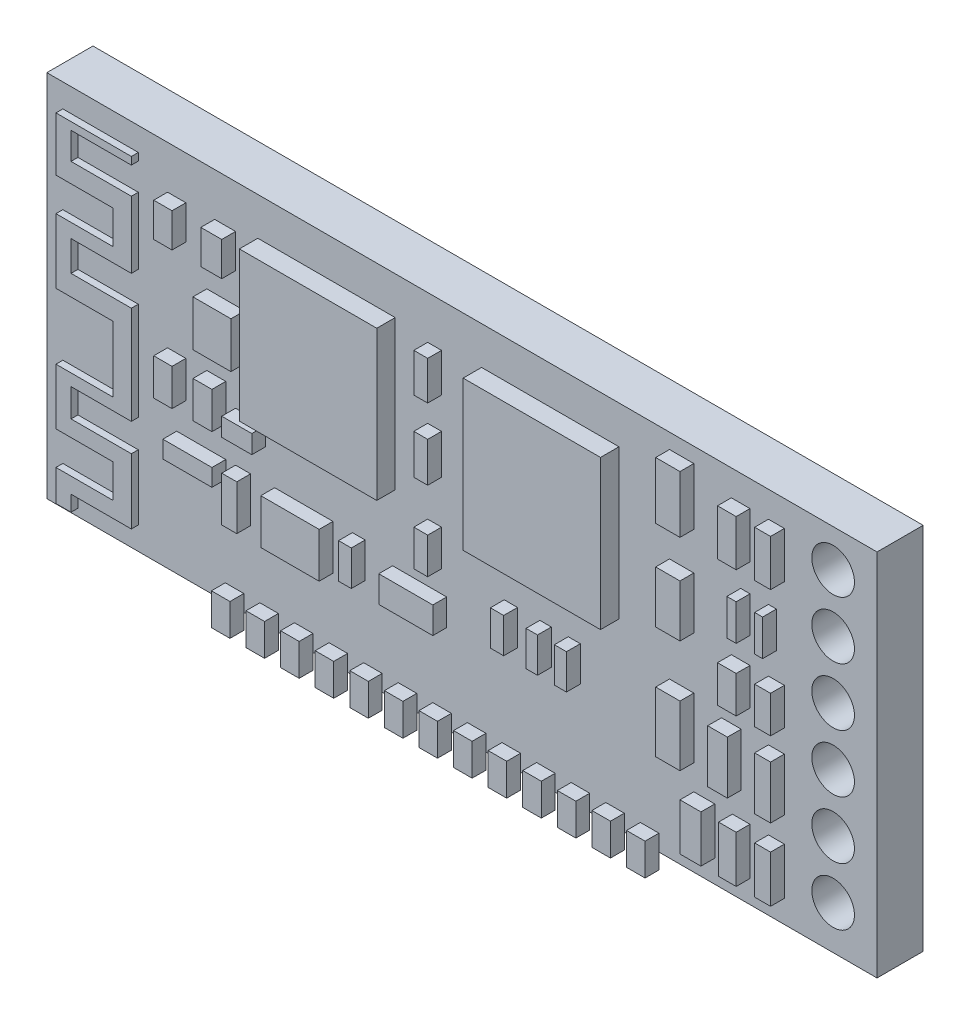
SolidWorks part; units mm, degrees
ref_plane "정면" through (0, 0, 0) normal (0, 0, 1) x (1, 0, 0)
ref_plane "윗면" through (0, 0, 0) normal (0, 1, 0) x (1, 0, 0)
ref_plane "우측면" through (0, 0, 0) normal (1, 0, 0) x (0, 0, -1)
sketch "스케치1" plane through (0, 0, 0) normal (0, 0, 1) x (1, 0, 0)
  line L1 (-50.3316, 76.0919) -> (-46.7316, 76.0919)
  line L2 (-50.3316, 76.0919) -> (-50.3316, 74.4919)
  line L3 (-50.3316, 74.4919) -> (-46.7316, 74.4919)
  line L4 (-46.7316, 76.0919) -> (-46.7316, 74.4919)
  line L5 (-50.3316, 76.0919) -> (-46.7316, 74.4919) construction
  line L6 (-50.3316, 74.4919) -> (-46.7316, 76.0919) construction
  point P0 (-48.5316, 75.2919)
extrude "보스-돌출1" add sketch "스케치1" along normal blind 0.2
sketch "스케치2" plane through (0, 0, 0.2) normal (0, 0, 1) x (1, 0, 0)
  circle A0 centre (-46.9221, 75.9292) radius 0.0924
  circle A1 centre (-46.9221, 75.6792) radius 0.0924
  circle A2 centre (-46.9221, 75.4292) radius 0.0924
  circle A3 centre (-46.9221, 75.1792) radius 0.0924
  circle A4 centre (-46.9221, 74.9292) radius 0.0924
  circle A5 centre (-46.9221, 74.6792) radius 0.0924
  dimension "D1" = 6
extrude "컷-돌출1" cut sketch "스케치2" against normal blind 0.2
sketch "스케치3" plane through (0, 0, 0.2) normal (0, 0, 1) x (1, 0, 0)
  line L0 (-49.9725, 75.9904) -> (-50.2622, 75.9904)
  line L1 (-50.2622, 75.9904) -> (-50.2622, 75.7569)
  line L2 (-50.2622, 75.7569) -> (-50.0146, 75.7569)
  line L3 (-50.0146, 75.7569) -> (-50.0146, 75.612)
  line L4 (-50.0146, 75.612) -> (-50.2622, 75.612)
  line L5 (-50.2622, 75.612) -> (-50.2622, 75.3317)
  line L6 (-50.2622, 75.3317) -> (-50.0146, 75.3317)
  line L7 (-50.0146, 75.3317) -> (-50.0146, 75.0468)
  line L8 (-50.0146, 75.0468) -> (-50.2622, 75.0468)
  line L9 (-50.2622, 75.0468) -> (-50.2622, 74.8039)
  line L10 (-50.2622, 74.8039) -> (-50.0146, 74.8039)
  line L11 (-50.0146, 74.8039) -> (-50.0146, 74.659)
  line L12 (-50.0146, 74.659) -> (-50.2622, 74.659)
  line L13 (-50.2622, 74.659) -> (-50.2622, 74.5236)
  line L14 (-50.2622, 74.5236) -> (-50.1968, 74.5236)
  line L15 (-50.1968, 74.5236) -> (-50.1968, 74.5913)
  line L16 (-50.1968, 74.5913) -> (-49.9352, 74.5913)
  line L17 (-49.9352, 74.5913) -> (-49.9352, 74.8739)
  line L18 (-49.9352, 74.8739) -> (-50.1968, 74.8739)
  line L19 (-50.1968, 74.8739) -> (-50.1968, 74.9954)
  line L20 (-50.1968, 74.9954) -> (-49.9352, 74.9954)
  line L21 (-49.9352, 74.9954) -> (-49.9352, 75.4205)
  line L22 (-49.9352, 75.4205) -> (-50.1968, 75.4205)
  line L23 (-50.1968, 75.4205) -> (-50.1968, 75.5513)
  line L24 (-50.1968, 75.5513) -> (-49.9352, 75.5513)
  line L25 (-49.9352, 75.5513) -> (-49.9352, 75.841)
  line L26 (-49.9352, 75.841) -> (-50.1968, 75.841)
  line L27 (-50.1968, 75.841) -> (-50.1968, 75.9577)
  line L28 (-50.1968, 75.9577) -> (-49.9352, 75.9577)
  line L29 (-49.9352, 75.9577) -> (-49.9352, 75.9904)
  line L30 (-49.9352, 75.9904) -> (-49.9725, 75.9904)
extrude "보스-돌출2" add sketch "스케치3" along normal blind 0.03
sketch "스케치4" plane through (0, 0, 0.2) normal (0, 0, 1) x (1, 0, 0)
  line L1 (-48.4465, 75.9274) -> (-47.8508, 75.9274)
  line L2 (-48.4465, 75.9274) -> (-48.4465, 75.2806)
  line L3 (-48.4465, 75.2806) -> (-47.8508, 75.2806)
  line L4 (-47.8508, 75.9274) -> (-47.8508, 75.2806)
  line L5 (-49.4167, 75.9274) -> (-48.821, 75.9274)
  line L6 (-49.4167, 75.9274) -> (-49.4167, 75.2806)
  line L7 (-49.4167, 75.2806) -> (-48.821, 75.2806)
  line L8 (-48.821, 75.9274) -> (-48.821, 75.2806)
extrude "보스-돌출3" add sketch "스케치4" along normal blind 0.08
sketch "스케치5" plane through (0, 0, 0.2) normal (0, 0, 1) x (1, 0, 0)
  line L1 (-49.604, 75.9047) -> (-49.5132, 75.9047)
  line L2 (-49.604, 75.9047) -> (-49.604, 75.7572)
  line L3 (-49.604, 75.7572) -> (-49.5132, 75.7572)
  line L4 (-49.5132, 75.9047) -> (-49.5132, 75.7572)
  line L5 (-49.8082, 75.9047) -> (-49.7288, 75.9047)
  line L6 (-49.8082, 75.9047) -> (-49.8082, 75.7572)
  line L7 (-49.8082, 75.7572) -> (-49.7288, 75.7572)
  line L8 (-49.7288, 75.9047) -> (-49.7288, 75.7572)
  line L9 (-49.638, 75.6267) -> (-49.4735, 75.6267)
  line L10 (-49.638, 75.6267) -> (-49.638, 75.4281)
  line L11 (-49.638, 75.4281) -> (-49.4735, 75.4281)
  line L12 (-49.4735, 75.6267) -> (-49.4735, 75.4281)
  line L13 (-49.8082, 75.3203) -> (-49.7288, 75.3203)
  line L14 (-49.8082, 75.3203) -> (-49.8082, 75.1614)
  line L15 (-49.8082, 75.1614) -> (-49.7288, 75.1614)
  line L16 (-49.7288, 75.3203) -> (-49.7288, 75.1614)
  line L17 (-49.638, 75.3203) -> (-49.5557, 75.3203)
  line L18 (-49.638, 75.3203) -> (-49.638, 75.1614)
  line L19 (-49.638, 75.1614) -> (-49.5557, 75.1614)
  line L20 (-49.5557, 75.3203) -> (-49.5557, 75.1614)
  line L21 (-49.5132, 75.2409) -> (-49.3829, 75.2409)
  line L22 (-49.5132, 75.2409) -> (-49.5132, 75.1614)
  line L23 (-49.5132, 75.1614) -> (-49.3829, 75.1614)
  line L24 (-49.3829, 75.2409) -> (-49.3829, 75.1614)
  line L25 (-49.7685, 75.027) -> (-49.5557, 75.027)
  line L26 (-49.7685, 75.027) -> (-49.7685, 74.9524)
  line L27 (-49.7685, 74.9524) -> (-49.5557, 74.9524)
  line L28 (-49.5557, 75.027) -> (-49.5557, 74.9524)
  line L29 (-49.5132, 75.027) -> (-49.448, 75.027)
  line L30 (-49.5132, 75.027) -> (-49.5132, 74.8323)
  line L31 (-49.5132, 74.8323) -> (-49.448, 74.8323)
  line L32 (-49.448, 75.027) -> (-49.448, 74.8323)
  line L33 (-49.344, 75.027) -> (-49.0909, 75.027)
  line L34 (-49.344, 75.027) -> (-49.344, 74.8323)
  line L35 (-49.344, 74.8323) -> (-49.0909, 74.8323)
  line L36 (-49.0909, 75.027) -> (-49.0909, 74.8323)
  line L37 (-49.0066, 75.027) -> (-48.9514, 75.027)
  line L38 (-49.0066, 75.027) -> (-49.0066, 74.8745)
  line L39 (-49.0066, 74.8745) -> (-48.9514, 74.8745)
  line L40 (-48.9514, 75.027) -> (-48.9514, 74.8745)
  line L41 (-48.8323, 74.9897) -> (-48.598, 74.9897)
  line L42 (-48.8323, 74.9897) -> (-48.8323, 74.8745)
  line L43 (-48.8323, 74.8745) -> (-48.598, 74.8745)
  line L44 (-48.598, 74.9897) -> (-48.598, 74.8745)
  line L45 (-48.6803, 75.2409) -> (-48.6201, 75.2409)
  line L46 (-48.6803, 75.2409) -> (-48.6803, 75.0843)
  line L47 (-48.6803, 75.0843) -> (-48.6201, 75.0843)
  line L48 (-48.6201, 75.2409) -> (-48.6201, 75.0843)
  line L49 (-48.6803, 75.6005) -> (-48.6201, 75.6005)
  line L50 (-48.6803, 75.6005) -> (-48.6803, 75.4281)
  line L51 (-48.6803, 75.4281) -> (-48.6201, 75.4281)
  line L52 (-48.6201, 75.6005) -> (-48.6201, 75.4281)
  line L53 (-48.6803, 75.9047) -> (-48.6201, 75.9047)
  line L54 (-48.6803, 75.9047) -> (-48.6803, 75.7367)
  line L55 (-48.6803, 75.7367) -> (-48.6201, 75.7367)
  line L56 (-48.6201, 75.9047) -> (-48.6201, 75.7367)
  line L57 (-48.3482, 75.104) -> (-48.2906, 75.104)
  line L58 (-48.3482, 75.104) -> (-48.3482, 74.9524)
  line L59 (-48.3482, 74.9524) -> (-48.2906, 74.9524)
  line L60 (-48.2906, 75.104) -> (-48.2906, 74.9524)
  line L61 (-48.1937, 75.104) -> (-48.144, 75.104)
  line L62 (-48.1937, 75.104) -> (-48.1937, 74.9524)
  line L63 (-48.1937, 74.9524) -> (-48.144, 74.9524)
  line L64 (-48.144, 75.104) -> (-48.144, 74.9524)
  line L65 (-48.0707, 75.104) -> (-48.0183, 75.104)
  line L66 (-48.0707, 75.104) -> (-48.0707, 74.9524)
  line L67 (-48.0707, 74.9524) -> (-48.0183, 74.9524)
  line L68 (-48.0183, 75.104) -> (-48.0183, 74.9524)
extrude "보스-돌출4" add sketch "스케치5" along normal blind 0.06
sketch "스케치6" plane through (0, 0, 0.2) normal (0, 0, 1) x (1, 0, 0)
  line L0 (-49.408, 74.5629) -> (-49.3275, 74.5629)
  line L1 (-49.558, 74.5629) -> (-49.4775, 74.5629)
  line L2 (-49.558, 74.5629) -> (-49.558, 74.4243)
  line L3 (-49.558, 74.4243) -> (-49.4775, 74.4243)
  line L4 (-49.4775, 74.5629) -> (-49.4775, 74.4243)
  line L5 (-49.408, 74.5629) -> (-49.408, 74.4243)
  line L6 (-49.3275, 74.5629) -> (-49.3275, 74.4243)
  line L7 (-49.408, 74.4243) -> (-49.3275, 74.4243)
  line L8 (-49.258, 74.5629) -> (-49.1775, 74.5629)
  line L9 (-49.258, 74.5629) -> (-49.258, 74.4243)
  line L10 (-49.1775, 74.5629) -> (-49.1775, 74.4243)
  line L11 (-49.258, 74.4243) -> (-49.1775, 74.4243)
  line L12 (-49.108, 74.5629) -> (-49.0275, 74.5629)
  line L13 (-49.108, 74.5629) -> (-49.108, 74.4243)
  line L14 (-49.0275, 74.5629) -> (-49.0275, 74.4243)
  line L15 (-49.108, 74.4243) -> (-49.0275, 74.4243)
  line L16 (-48.958, 74.5629) -> (-48.8775, 74.5629)
  line L17 (-48.958, 74.5629) -> (-48.958, 74.4243)
  line L18 (-48.8775, 74.5629) -> (-48.8775, 74.4243)
  line L19 (-48.958, 74.4243) -> (-48.8775, 74.4243)
  line L20 (-48.808, 74.5629) -> (-48.7275, 74.5629)
  line L21 (-48.808, 74.5629) -> (-48.808, 74.4243)
  line L22 (-48.7275, 74.5629) -> (-48.7275, 74.4243)
  line L23 (-48.808, 74.4243) -> (-48.7275, 74.4243)
  line L24 (-48.658, 74.5629) -> (-48.5775, 74.5629)
  line L25 (-48.658, 74.5629) -> (-48.658, 74.4243)
  line L26 (-48.5775, 74.5629) -> (-48.5775, 74.4243)
  line L27 (-48.658, 74.4243) -> (-48.5775, 74.4243)
  line L28 (-48.508, 74.5629) -> (-48.4275, 74.5629)
  line L29 (-48.508, 74.5629) -> (-48.508, 74.4243)
  line L30 (-48.4275, 74.5629) -> (-48.4275, 74.4243)
  line L31 (-48.508, 74.4243) -> (-48.4275, 74.4243)
  line L32 (-48.358, 74.5629) -> (-48.2775, 74.5629)
  line L33 (-48.358, 74.5629) -> (-48.358, 74.4243)
  line L34 (-48.2775, 74.5629) -> (-48.2775, 74.4243)
  line L35 (-48.358, 74.4243) -> (-48.2775, 74.4243)
  line L36 (-48.208, 74.5629) -> (-48.1275, 74.5629)
  line L37 (-48.208, 74.5629) -> (-48.208, 74.4243)
  line L38 (-48.1275, 74.5629) -> (-48.1275, 74.4243)
  line L39 (-48.208, 74.4243) -> (-48.1275, 74.4243)
  line L40 (-48.058, 74.5629) -> (-47.9775, 74.5629)
  line L41 (-48.058, 74.5629) -> (-48.058, 74.4243)
  line L42 (-47.9775, 74.5629) -> (-47.9775, 74.4243)
  line L43 (-48.058, 74.4243) -> (-47.9775, 74.4243)
  line L44 (-47.908, 74.5629) -> (-47.8275, 74.5629)
  line L45 (-47.908, 74.5629) -> (-47.908, 74.4243)
  line L46 (-47.8275, 74.5629) -> (-47.8275, 74.4243)
  line L47 (-47.908, 74.4243) -> (-47.8275, 74.4243)
  line L48 (-47.758, 74.5629) -> (-47.6775, 74.5629)
  line L49 (-47.758, 74.5629) -> (-47.758, 74.4243)
  line L50 (-47.6775, 74.5629) -> (-47.6775, 74.4243)
  line L51 (-47.758, 74.4243) -> (-47.6775, 74.4243)
  dimension "D1" = 13
extrude "보스-돌출5" add sketch "스케치6" along normal blind 0.06
sketch "스케치7" plane through (0, 0, 0.2) normal (0, 0, 1) x (1, 0, 0)
  line L1 (-47.6316, 76.0266) -> (-47.5261, 76.0266)
  line L2 (-47.6316, 76.0266) -> (-47.6316, 75.7793)
  line L3 (-47.6316, 75.7793) -> (-47.5261, 75.7793)
  line L4 (-47.5261, 76.0266) -> (-47.5261, 75.7793)
  line L5 (-47.6316, 75.6157) -> (-47.5261, 75.6157)
  line L6 (-47.6316, 75.6157) -> (-47.6316, 75.3902)
  line L7 (-47.6316, 75.3902) -> (-47.5261, 75.3902)
  line L8 (-47.5261, 75.6157) -> (-47.5261, 75.3902)
  line L9 (-47.6316, 75.1647) -> (-47.5261, 75.1647)
  line L10 (-47.6316, 75.1647) -> (-47.6316, 74.9029)
  line L11 (-47.6316, 74.9029) -> (-47.5261, 74.9029)
  line L12 (-47.5261, 75.1647) -> (-47.5261, 74.9029)
  line L13 (-47.5261, 74.7938) -> (-47.4352, 74.7938)
  line L14 (-47.5261, 74.7938) -> (-47.5261, 74.5901)
  line L15 (-47.5261, 74.5901) -> (-47.4352, 74.5901)
  line L16 (-47.4352, 74.7938) -> (-47.4352, 74.5901)
  line L17 (-47.3589, 74.7938) -> (-47.2825, 74.7938)
  line L18 (-47.3589, 74.7938) -> (-47.3589, 74.5901)
  line L19 (-47.3589, 74.5901) -> (-47.2825, 74.5901)
  line L20 (-47.2825, 74.7938) -> (-47.2825, 74.5901)
  line L21 (-47.2025, 74.7938) -> (-47.1334, 74.7938)
  line L22 (-47.2025, 74.7938) -> (-47.2025, 74.5901)
  line L23 (-47.2025, 74.5901) -> (-47.1334, 74.5901)
  line L24 (-47.1334, 74.7938) -> (-47.1334, 74.5901)
  line L25 (-47.4061, 75.132) -> (-47.3207, 75.132)
  line L26 (-47.4061, 75.132) -> (-47.4061, 74.9029)
  line L27 (-47.4061, 74.9029) -> (-47.3207, 74.9029)
  line L28 (-47.3207, 75.132) -> (-47.3207, 74.9029)
  line L29 (-47.2025, 75.132) -> (-47.1334, 75.132)
  line L30 (-47.2025, 75.132) -> (-47.2025, 74.9029)
  line L31 (-47.2025, 74.9029) -> (-47.1334, 74.9029)
  line L32 (-47.1334, 75.132) -> (-47.1334, 74.9029)
  line L33 (-47.3634, 75.3902) -> (-47.2825, 75.3902)
  line L34 (-47.3634, 75.3902) -> (-47.3634, 75.2302)
  line L35 (-47.3634, 75.2302) -> (-47.2825, 75.2302)
  line L36 (-47.2825, 75.3902) -> (-47.2825, 75.2302)
  line L37 (-47.2025, 75.3902) -> (-47.1334, 75.3902)
  line L38 (-47.2025, 75.3902) -> (-47.2025, 75.2302)
  line L39 (-47.2025, 75.2302) -> (-47.1334, 75.2302)
  line L40 (-47.1334, 75.3902) -> (-47.1334, 75.2302)
  line L41 (-47.3634, 75.9793) -> (-47.2825, 75.9793)
  line L42 (-47.3634, 75.9793) -> (-47.3634, 75.7793)
  line L43 (-47.3634, 75.7793) -> (-47.2825, 75.7793)
  line L44 (-47.2825, 75.9793) -> (-47.2825, 75.7793)
  line L45 (-47.2025, 75.9793) -> (-47.1334, 75.9793)
  line L46 (-47.2025, 75.9793) -> (-47.2025, 75.7793)
  line L47 (-47.2025, 75.7793) -> (-47.1334, 75.7793)
  line L48 (-47.1334, 75.9793) -> (-47.1334, 75.7793)
  line L49 (-47.3229, 75.6593) -> (-47.2825, 75.6593)
  line L50 (-47.3229, 75.6593) -> (-47.3229, 75.5029)
  line L51 (-47.3229, 75.5029) -> (-47.2825, 75.5029)
  line L52 (-47.2825, 75.6593) -> (-47.2825, 75.5029)
  line L53 (-47.2025, 75.6593) -> (-47.1679, 75.6593)
  line L54 (-47.2025, 75.6593) -> (-47.2025, 75.5029)
  line L55 (-47.2025, 75.5029) -> (-47.1679, 75.5029)
  line L56 (-47.1679, 75.6593) -> (-47.1679, 75.5029)
extrude "보스-돌출6" add sketch "스케치7" along normal blind 0.06
